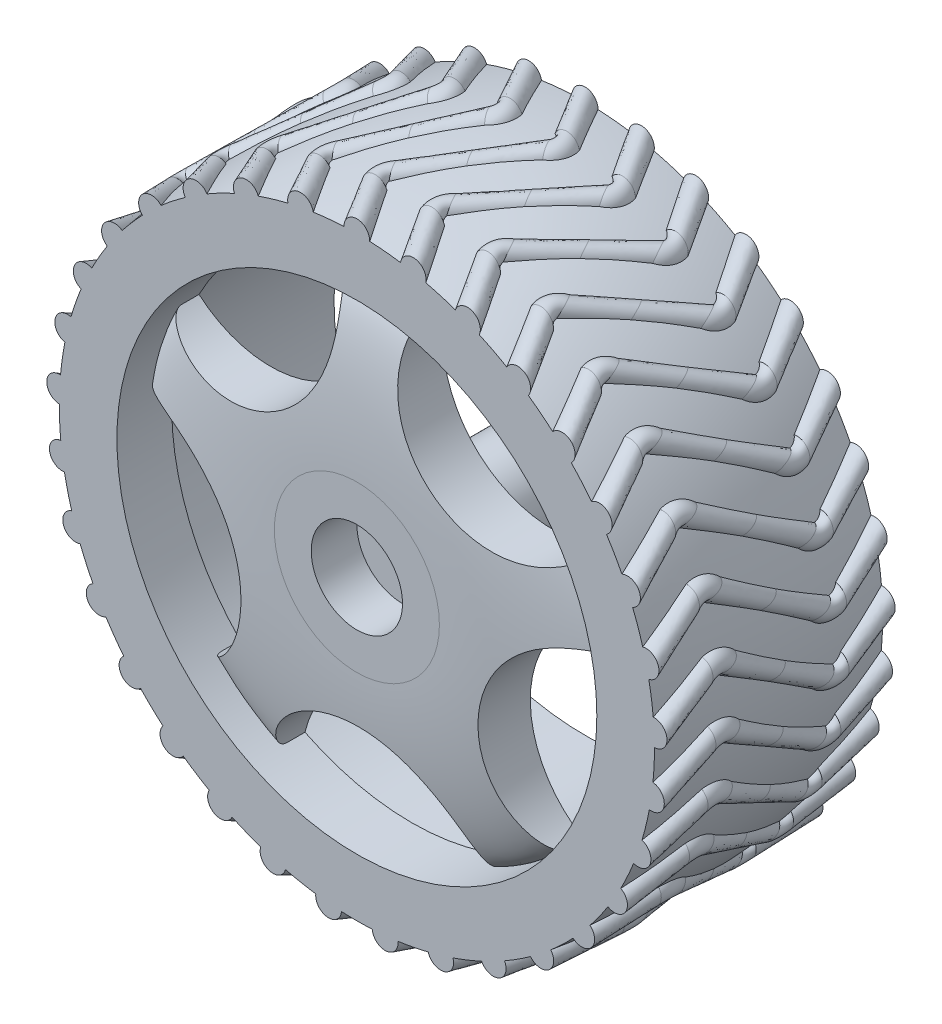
SolidWorks part; units mm, degrees
ref_plane "Front Plane" through (0, 0, 0) normal (0, 0, 1) x (1, 0, 0)
ref_plane "Top Plane" through (0, 0, 0) normal (0, 1, 0) x (1, 0, 0)
ref_plane "Right Plane" through (0, 0, 0) normal (1, 0, 0) x (0, 0, -1)
sketch "Sketch1" plane through (0, 0, 0) normal (0, 0, 1) x (1, 0, 0)
  circle A0 centre (0, 0) radius 2
  circle A1 centre (0, 0) radius 33.5
  dimension "D1" = 4
  dimension "D2" = 67
extrude "Boss-Extrude1" add sketch "Sketch1" along normal blind 25
sketch "Sketch2" plane through (0, 0, 0) normal (0, 0, -1) x (-1, 0, 0)
  circle A0 centre (0, 0) radius 5
  circle A1 centre (0, 0) radius 27.5
  dimension "D1" = 10
  dimension "D2" = 55
extrude "Cut-Extrude1" cut sketch "Sketch2" against normal blind 19
sketch "Sketch3" plane through (0, 0, 25) normal (0, 0, 1) x (1, 0, 0)
  circle A0 centre (0, 0) radius 2
  circle A1 centre (0, 0) radius 5
  dimension "D1" = 10
  dimension "D2" = 4
extrude "Cut-Extrude2" cut sketch "Sketch3" against normal blind 5
sketch "Sketch4" plane through (0, 0, 0) normal (1, 0, 0) x (0, 0, -1)
  line L0 (-25, 26.281) -> (-20.9342, 26.281)
  line L1 (-25, 33.5) -> (-25, -33.5) construction
  line L2 (-25, 26.281) -> (-25, 9.0399)
  line L3 (-25, 0) -> (0, 0) construction
  ellipse E0 centre (-20.9342, 9.0399) end of major axis (-20.9342, 26.281) minor radius 4.0658 (-20.9342, 26.281) -> (-25, 9.0399) ccw
revolve "Cut-Revolve1" cut sketch "Sketch4" angle 360 about L3
sketch "Sketch5" plane through (0, 0, 25) normal (0, 0, 1) x (1, 0, 0)
  arc A0 (11.6831, -23.5414) -> (-11.6831, -23.5414) centre (0, -26.281) ccw
  circle A1 centre (0, 0) radius 26.281 construction
  arc A2 (-11.6831, -23.5414) -> (11.6831, -23.5414) centre (0, 0) ccw
  arc A3 (-18.779, -18.386) -> (-25.9995, 3.8366) centre (-24.9948, -8.1213) ccw
  arc A4 (-25.9995, 3.8366) -> (-18.779, -18.386) centre (0, 0) ccw
  arc A5 (-23.2891, 12.1783) -> (-4.3855, 25.9126) centre (-15.4476, 21.2618) ccw
  arc A6 (-4.3855, 25.9126) -> (-23.2891, 12.1783) centre (0, 0) ccw
  arc A7 (4.3855, 25.9126) -> (23.2891, 12.1783) centre (15.4476, 21.2618) ccw
  arc A8 (23.2891, 12.1783) -> (4.3855, 25.9126) centre (0, 0) ccw
  arc A9 (25.9995, 3.8366) -> (18.779, -18.386) centre (24.9948, -8.1213) ccw
  arc A10 (18.779, -18.386) -> (25.9995, 3.8366) centre (0, 0) ccw
  point P22 (0, 0)
  dimension "D2" = 12
  dimension "D1" = 5
extrude "Cut-Extrude3" cut sketch "Sketch5" against normal blind 25
sketch "Sketch6" plane through (0, 0, 0) normal (1, 0, 0) x (0, 0, -1)
  line L0 (-25, 33.5) -> (0, 33.5)
  line L1 (-12.5, 33.5) -> (-12.5, -52.7462) construction
  line L2 (-25, 33.5) -> (-25, 32.5894)
  line L4 (0, 33.5) -> (0, 32.5894)
  line L5 (0, 0) -> (-25, 0) construction
  line L6 (-25, 33.5) -> (-25, -33.5) construction
  arc A0 (0, 32.5894) -> (-25, 32.5894) centre (-12.5, -52.7462) ccw
  dimension "D1" = 86.2462
  dimension "D2" = 0.9106
revolve "Cut-Revolve2" cut sketch "Sketch6" angle 360 about L5
ref_plane "Plane1" through (0, 34, 0) normal (0, 1, 0) x (1, 0, 0)
sketch "Sketch7" plane through (0, 34, 0) normal (0, 1, 0) x (1, 0, 0)
  line L0 (0, 0) -> (0, -25) construction
  line L1 (-32.5894, -25) -> (32.5894, -25) construction
  line L2 (33.5, -12.5) -> (-33.5, -12.5) construction
  line L3 (0, 0) -> (3.203, -5.2013)
  line L4 (3.203, -7.2987) -> (0, -12.5)
  line L7 (0, -25) -> (-3.203, -19.7987)
  line L8 (-3.203, -17.7013) -> (0, -12.5)
  arc A0 (32.5894, -25) -> (32.5894, 0) centre (-52.7462, -12.5) ccw construction
  arc A1 (-32.5894, 0) -> (-32.5894, -25) centre (52.7462, -12.5) ccw construction
  arc A2 (-3.203, -19.7987) -> (-3.203, -17.7013) centre (-1.5, -18.75) cw
  arc A3 (3.203, -7.2987) -> (3.203, -5.2013) centre (1.5, -6.25) ccw
  dimension "D1" = 2
  dimension "D2" = 1.5
  dimension "D3" = 1.5
sketch "Sketch8" plane through (0, 0, 0) normal (0, 0, 1) x (1, 0, 0)
  line L2 (0, 34) -> (0, 32.5894) construction
  line L3 (0, 34) -> (-3.203, 34) construction
  line L4 (-3.203, 34) -> (0, 34) construction
  circle A0 centre (0, 0) radius 32.5894 construction
  circle A1 centre (0, 32.5894) radius 1.4106
sweep "Sweep1" add profiles "Sketch8" path "Sketch7"
pattern_circular "CirPattern1" count 33 over 360 about axis through (0, 0, 25) along (0, 0, -1) of "Sweep1"
sketch "Sketch9" plane through (0, 0, 0) normal (0, 0, -1) x (-1, 0, 0)
  line L0 (-2.75, 0) -> (2.75, 0) construction
  line L1 (-1.4283, -2.35) -> (1.4283, -2.35)
  line L2 (-2.75, 0) -> (2.75, 0)
  line L3 (-1.4283, 2.35) -> (1.4283, 2.35)
  line L4 (-2.75, 2.35) -> (2.75, 2.35) construction
  line L5 (-2.75, -2.35) -> (2.75, -2.35) construction
  arc A0 (-1.4283, 2.35) -> (-1.4283, -2.35) centre (0, 0) ccw
  arc A1 (1.4283, -2.35) -> (1.4283, 2.35) centre (0, 0) ccw
  dimension "D1" = 5.5
  dimension "D2" = 2.35
  dimension "D3" = 2.35
extrude "Cut-Extrude4" cut sketch "Sketch9" against normal blind 8 contours L2 A1 L3 A0 M3 | L1 A1 L2 A0 M3
